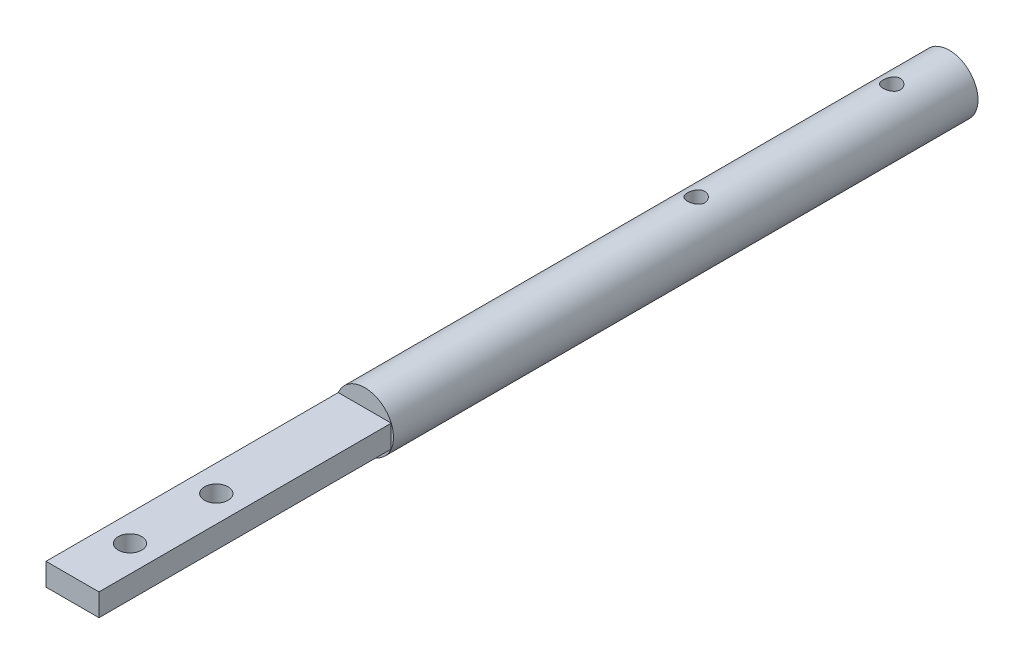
SolidWorks part; units mm, degrees
ref_plane "Front Plane" through (0, 0, 0) normal (0, 0, 1) x (1, 0, 0)
ref_plane "Top Plane" through (0, 0, 0) normal (0, 1, 0) x (1, 0, 0)
ref_plane "Right Plane" through (0, 0, 0) normal (1, 0, 0) x (0, 0, -1)
sketch "Sketch1" plane through (0, 0, 0) normal (0, 0, 1) x (1, 0, 0)
  circle A0 centre (0, 0) radius 2.5
  dimension "D1" = 5
extrude "Boss-Extrude1" add sketch "Sketch1" along normal blind 50.8
sketch "Sketch2" plane through (0, 0, 50.8) normal (0, 0, 1) x (1, 0, 0)
  line L1 (2.3024, -0.9741) -> (-2.3024, -0.9741)
  line L2 (2.3024, -0.9741) -> (2.3024, 0.9741)
  line L3 (2.3024, 0.9741) -> (-2.3024, 0.9741)
  line L4 (-2.3024, -0.9741) -> (-2.3024, 0.9741)
  line L5 (2.3024, -0.9741) -> (-2.3024, 0.9741) construction
  line L6 (2.3024, 0.9741) -> (-2.3024, -0.9741) construction
  circle A0 centre (0, 0) radius 2.5 construction
  point P0 (0, 0)
extrude "Boss-Extrude2" add sketch "Sketch2" along normal blind 25.4
sketch "Sketch3" plane through (0, 0.9741, 0) normal (0, 1, 0) x (1, 0, 0)
  line L0 (2.3024, -76.2) -> (-2.3024, -76.2) construction
  circle A0 centre (0, -63.7) radius 1.0227
  circle A1 centre (0, -71.2) radius 1.0227
  point P6 (0, -76.2)
  dimension "D1" = 5
  dimension "D2" = 12.5
extrude "Cut-Extrude1" cut sketch "Sketch3" against normal through all
sketch "Sketch4" plane through (0, 0, 0) normal (0, 1, 0) x (1, 0, 0)
  line L0 (0, 0) -> (0, -14.2164) construction
  line L1 (2.5, 0) -> (-2.5, 0) construction
  circle A0 centre (0, -5) radius 0.75
  circle A1 centre (0, -22) radius 0.75
  dimension "D1" = 1.5
  dimension "D2" = 1.5
  dimension "D3" = 17
  dimension "D4" = 5
extrude "Cut-Extrude2" cut sketch "Sketch4" against normal through all and the other way through all
